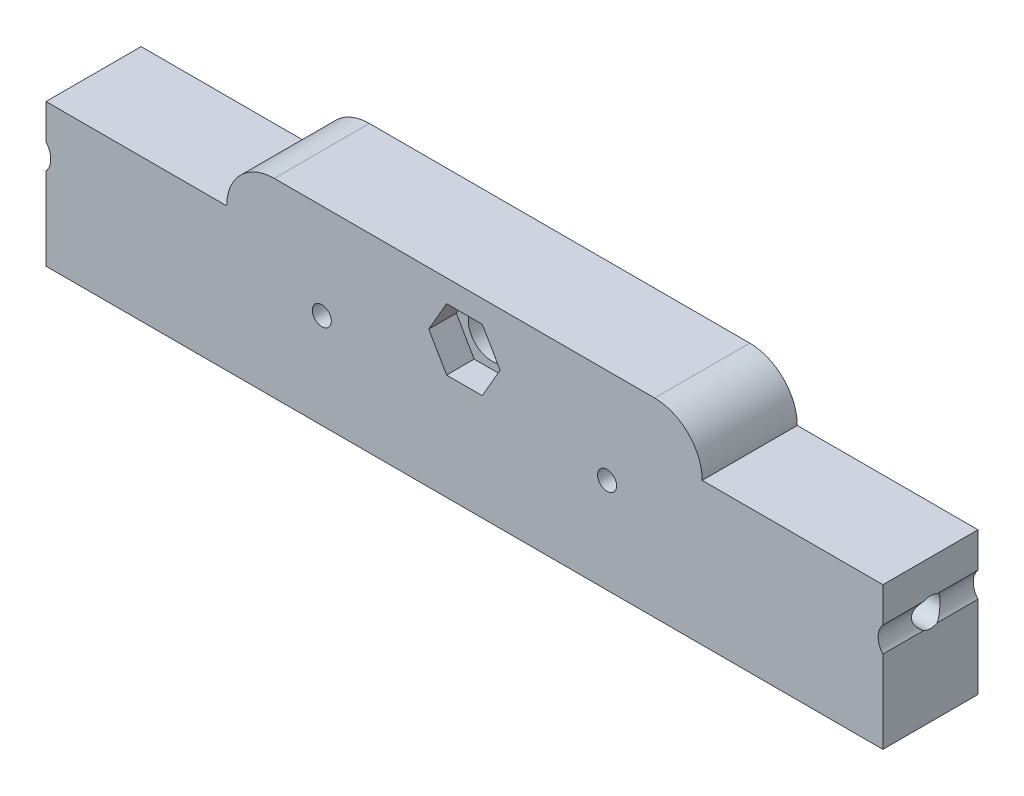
SolidWorks part; units mm, degrees
ref_plane "Face" through (0, 0, 0) normal (0, 0, 1) x (1, 0, 0)
ref_plane "Dessus" through (0, 0, 0) normal (0, 1, 0) x (1, 0, 0)
ref_plane "Droite" through (0, 0, 0) normal (1, 0, 0) x (0, 0, -1)
sketch "Esquisse1" plane through (0, 0, 0) normal (0, 0, 1) x (1, 0, 0)
  line L0 (-61.0445, 23.8909) -> (-61.0445, 18.8909)
  line L1 (-61.0445, 23.8909) -> (-11.0445, 23.8909)
  line L2 (-80.0445, 18.8909) -> (-80.0445, 3.8909)
  line L3 (-80.0445, 3.8909) -> (7.9555, 3.8909)
  line L4 (7.9555, 18.8909) -> (7.9555, 3.8909)
  line L5 (-61.0445, 18.8909) -> (-80.0445, 18.8909)
  line L6 (7.9555, 18.8909) -> (-11.0445, 18.8909)
  line L7 (-11.0445, 18.8909) -> (-11.0445, 23.8909)
  dimension "D1" = 88
  dimension "D2" = 20
  dimension "D3" = 5
  dimension "D4" = 5
  dimension "D5" = 19
  dimension "D6" = 19
extrude "Base-Extrusion" add sketch "Esquisse1" along normal blind 10
sketch "Esquisse2" plane through (0, 0, 10) normal (0, 0, 1) x (1, 0, 0)
  line L0 (7.9555, 3.8909) -> (7.9555, 18.8909) construction
  line L2 (-80.0445, 3.8909) -> (7.9555, 3.8909) construction
  circle A0 centre (-36.0445, 18.2909) radius 2.5
  circle A1 centre (-21.0445, 13.8909) radius 1
  circle A2 centre (-51.0445, 13.8909) radius 1
  dimension "D2" = 5
  dimension "D3" = 14.4
  dimension "D4" = 15
  dimension "D1" = 44
  dimension "D5" = 15
  dimension "D6" = 10
  dimension "D7" = 10
extrude "Enlèv. mat.-Extru.1" cut sketch "Esquisse2" against normal up to vertex
sketch "Esquisse3" plane through (-80.0445, 0, 0) normal (-1, 0, 0) x (0, 0, 1)
  line L0 (10, 23.8909) -> (0, 23.8909) construction
  line L1 (0, 18.8909) -> (0, 3.8909) construction
  circle A0 centre (5, 13.8909) radius 1.5
  dimension "D1" = 3
  dimension "D2" = 10
  dimension "D3" = 5
extrude "Enlèv. mat.-Extru.2" cut sketch "Esquisse3" against normal blind 10
sketch "Esquisse4" plane through (7.9555, 0, 0) normal (1, 0, 0) x (0, 0, -1)
  line L0 (-10, 23.8909) -> (0, 23.8909) construction
  line L1 (0, 3.8909) -> (0, 18.8909) construction
  circle A0 centre (-5, 13.8909) radius 1.5
  dimension "D1" = 3
  dimension "D2" = 10
  dimension "D3" = 5
extrude "Enlèv. mat.-Extru.3" cut sketch "Esquisse4" against normal blind 10
sketch "Esquisse5" plane through (0, 0, 10) normal (0, 0, 1) x (1, 0, 0)
  line L0 (7.9555, 3.8909) -> (7.9555, 18.8909) construction
  line L1 (-11.0445, 23.8909) -> (-61.0445, 23.8909) construction
  line L2 (-80.0445, 18.8909) -> (-80.0445, 3.8909) construction
  circle A0 centre (9.4555, 13.8909) radius 2
  circle A1 centre (-81.5445, 13.8909) radius 2
  dimension "D1" = 1.5
  dimension "D3" = 1.5
  dimension "D2" = 10
  dimension "D4" = 10
extrude "Enlèv. mat.-Extru.4" cut sketch "Esquisse5" against normal up to vertex
sketch "Esquisse6" plane through (0, 0, 10) normal (0, 0, 1) x (1, 0, 0)
  line L1 (-34.1681, 15.0409) -> (-32.2917, 18.2909)
  line L2 (-32.2917, 18.2909) -> (-34.1681, 21.5409)
  line L3 (-34.1681, 21.5409) -> (-37.9209, 21.5409)
  line L4 (-37.9209, 21.5409) -> (-39.7973, 18.2909)
  line L5 (-39.7973, 18.2909) -> (-37.9209, 15.0409)
  line L6 (-37.9209, 15.0409) -> (-34.1681, 15.0409)
  line L7 (-80.0445, 12.568) -> (-80.0445, 3.8909) construction
  line L8 (-80.0445, 3.8909) -> (7.9555, 3.8909) construction
  circle A0 centre (-36.0445, 18.2909) radius 3.25 construction
  dimension "D1" = 6.5
  dimension "D2" = 14.4
  dimension "D3" = 44
extrude "Enlèv. mat.-Extru.5" cut sketch "Esquisse6" against normal blind 2.9
fillet "Congé1" radius 5 2 edges at (-11.0445, 23.8909, 5) (-61.0445, 23.8909, 5)
